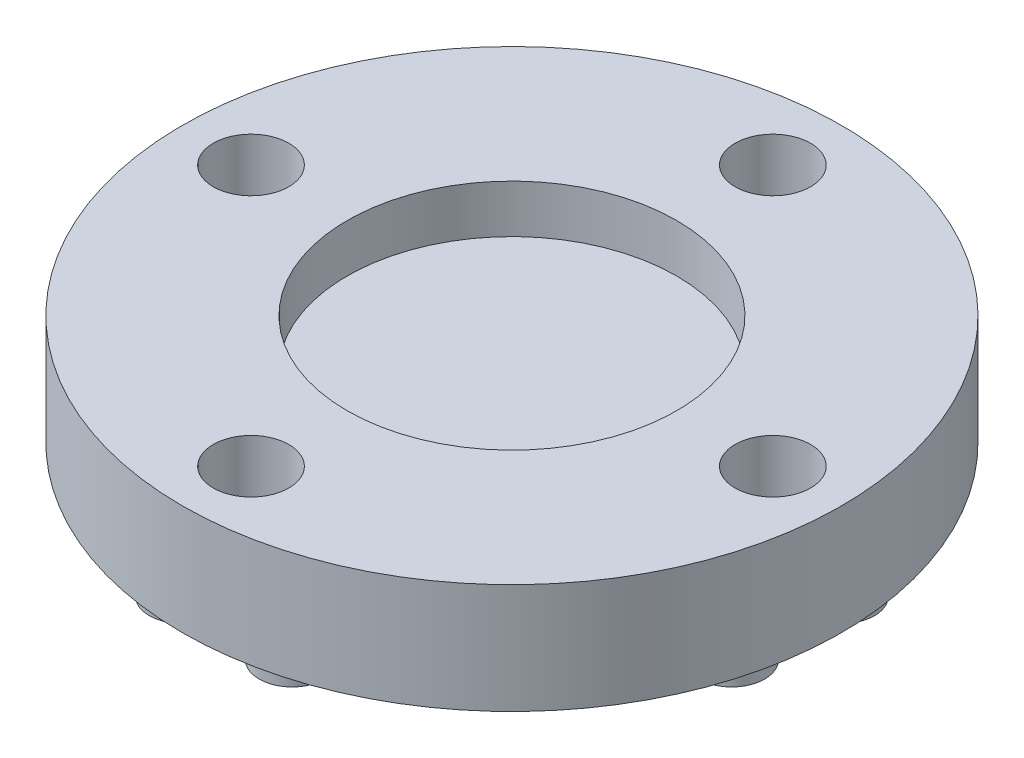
SolidWorks part; units mm, degrees
ref_plane "Front Plane" through (0, 0, 0) normal (0, 0, 1) x (1, 0, 0)
ref_plane "Top Plane" through (0, 0, 0) normal (0, 1, 0) x (1, 0, 0)
ref_plane "Right Plane" through (0, 0, 0) normal (1, 0, 0) x (0, 0, -1)
sketch "Sketch1" plane through (0, 0, 0) normal (0, 1, 0) x (1, 0, 0)
  circle A0 centre (0, 0) radius 24
  dimension "D1" = 48
extrude "Boss-Extrude1" add sketch "Sketch1" along normal blind 8
sketch "Sketch11" plane through (0, 0, 0) normal (0, -1, 0) x (1, 0, 0)
  circle A3 centre (-4, -20) radius 2.41
  circle A4 centre (4, -20) radius 2.41
  circle A9 centre (-12, -12) radius 2.41
  circle A10 centre (-4, -12) radius 2.41
  circle A11 centre (4, -12) radius 2.41
  circle A12 centre (12, -12) radius 2.41
  circle A16 centre (-12, -4) radius 2.41
  circle A17 centre (-4, -4) radius 2.41
  circle A18 centre (4, -4) radius 2.41
  circle A19 centre (12, -4) radius 2.41
  circle A20 centre (20, -4) radius 2.41
  circle A23 centre (-12, 4) radius 2.41
  circle A24 centre (-4, 4) radius 2.41
  circle A25 centre (4, 4) radius 2.41
  circle A26 centre (12, 4) radius 2.41
  circle A27 centre (20, 4) radius 2.41
  circle A30 centre (-12, 12) radius 2.41
  circle A31 centre (-4, 12) radius 2.41
  circle A32 centre (4, 12) radius 2.41
  circle A33 centre (12, 12) radius 2.41
  circle A38 centre (-4, 20) radius 2.41
  circle A39 centre (4, 20) radius 2.41
  circle A59 centre (-20, -4) radius 2.41
  circle A60 centre (-20, 4) radius 2.41
  dimension "D1" = 4.82
  dimension "D2" = 4.82
  dimension "D4" = 4.82
  dimension "D3" = 4.82
  dimension "D5" = 4.82
  dimension "D6" = 4.82
  dimension "D7" = 4.82
  dimension "D8" = 4.82
  dimension "D9" = 4.82
  dimension "D10" = 4.82
  dimension "D11" = 4.82
  dimension "D12" = 4.82
  dimension "D13" = 4.82
  dimension "D14" = 4.82
  dimension "D15" = 4.82
  dimension "D16" = 4.82
  dimension "D17" = 4.82
  dimension "D18" = 4.82
  dimension "D19" = 4.82
  dimension "D20" = 4.82
  dimension "D21" = 4.82
  dimension "D22" = 4.82
  dimension "D23" = 4.82
  dimension "D24" = 4.82
extrude "Boss-Extrude2" add sketch "Sketch11" along normal blind 1.72
sketch "Sketch12" plane through (0, 8, 0) normal (0, 1, 0) x (1, 0, 0)
  circle A2 centre (0, 0) radius 12
  dimension "D5" = 24
extrude "Cut-Extrude1" cut sketch "Sketch12" against normal blind 3.5
sketch "Sketch13" plane through (0, 8, 0) normal (0, 1, 0) x (1, 0, 0)
  circle A0 centre (-19, 0) radius 2.75
  circle A1 centre (0, 19) radius 2.75
  circle A2 centre (19, 0) radius 2.75
  circle A3 centre (0, -19) radius 2.75
  point P12 (0, 0)
  dimension "D1" = 5.5
  dimension "D2" = 19
  dimension "D3" = 4
extrude "Cut-Extrude2" cut sketch "Sketch13" against normal blind 5.5
